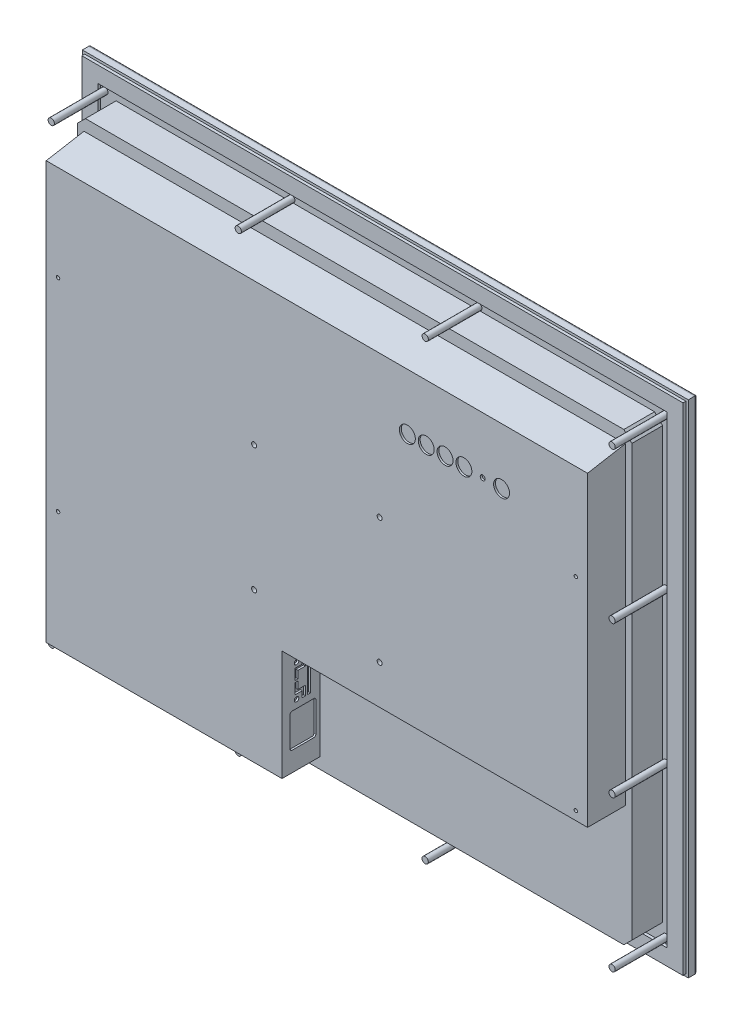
SolidWorks part; units mm, degrees
ref_plane "Front Plane" through (0, 0, 0) normal (0, 0, 1) x (1, 0, 0)
ref_plane "Top Plane" through (0, 0, 0) normal (0, 1, 0) x (1, 0, 0)
ref_plane "Right Plane" through (0, 0, 0) normal (1, 0, 0) x (0, 0, -1)
sketch "Sketch1" plane through (0, 0, 0) normal (0, 0, 1) x (1, 0, 0)
  line L0 (-241.3, 199.39) -> (241.3, 199.39)
  line L1 (241.3, 199.39) -> (241.3, -199.39)
  line L2 (241.3, -199.39) -> (-241.3, -199.39)
  line L3 (-241.3, -199.39) -> (-241.3, 199.39)
  point P2 (0, -199.39)
  point P3 (241.3, 0)
  dimension "D1" = 482.6
  dimension "D2" = 398.78
extrude "Bezel" add sketch "Sketch1" against normal blind 7.112
fillet "Bezel Radius" radius 2 4 edges at (0, -199.39, -7.112) (0, 199.39, -7.112) (-241.3, 0, -7.112) (241.3, 0, -7.112)
sketch "Sketch2" plane through (0, 0, -7.112) normal (0, 0, -1) x (-1, 0, 0)
  line L0 (-204.597, 153.797) -> (204.597, 153.797)
  line L1 (204.597, 153.797) -> (204.597, -153.797)
  line L2 (204.597, -153.797) -> (-204.597, -153.797)
  line L3 (-204.597, -153.797) -> (-204.597, 153.797)
  line L4 (239.3, 197.39) -> (-239.3, 197.39) construction
  line L5 (-239.3, 197.39) -> (-239.3, -197.39) construction
  point P0 (0, 153.797)
  point P6 (0, 197.39)
  point P8 (-204.597, 0)
  point P11 (-239.3, 0)
  dimension "D1" = 409.194
  dimension "D2" = 307.594
extrude "Window" cut sketch "Sketch2" against normal blind 2.35
sketch "Sketch3" plane through (0, 0, 0) normal (0, 0, 1) x (1, 0, 0)
  line L4 (-239.395, 197.485) -> (239.395, 197.485)
  line L5 (239.395, 197.485) -> (239.395, -197.485)
  line L6 (239.395, -197.485) -> (-239.395, -197.485)
  line L7 (-239.395, -197.485) -> (-239.395, 197.485)
  line L8 (241.3, 199.39) -> (-241.3, 199.39) construction
  line L9 (-241.3, 199.39) -> (-241.3, -199.39) construction
  line L10 (-241.3, -199.39) -> (241.3, -199.39) construction
  line L11 (241.3, -199.39) -> (241.3, 199.39) construction
  line L12 (-226.695, -184.785) -> (-226.695, 184.785)
  line L13 (-226.695, 184.785) -> (226.695, 184.785)
  line L14 (226.695, 184.785) -> (226.695, -184.785)
  line L15 (226.695, -184.785) -> (-226.695, -184.785)
  dimension "D1" = 1.905
  dimension "D2" = 1.905
  dimension "D3" = 1.905
  dimension "D4" = 1.905
  dimension "D5" = 12.7
extrude "Gasket" add sketch "Sketch3" along normal blind 2.3
sketch "Sketch5" plane through (0, 0, 0) normal (0, 0, 1) x (1, 0, 0)
  line L0 (-241.3, 199.39) -> (-241.3, -199.39) construction
  line L1 (241.3, 199.39) -> (-241.3, 199.39) construction
  line L2 (-241.3, -199.39) -> (241.3, -199.39) construction
  line L4 (241.3, -199.39) -> (241.3, 199.39) construction
  circle A0 centre (-223.3168, 180.213) radius 2.5
  circle A6 centre (-223.3168, -180.213) radius 2.5
  circle A8 centre (-74.4389, 180.213) radius 2.5
  circle A9 centre (-74.4389, -180.213) radius 2.5
  circle A10 centre (74.4389, 180.213) radius 2.5
  circle A11 centre (74.4389, -180.213) radius 2.5
  circle A12 centre (223.3168, 180.213) radius 2.5
  circle A13 centre (223.3168, -180.213) radius 2.5
  circle A14 centre (-223.3168, 60.071) radius 2.5
  circle A15 centre (223.3168, 60.071) radius 2.5
  circle A16 centre (-223.3168, -60.071) radius 2.5
  circle A17 centre (223.3168, -60.071) radius 2.5
  dimension "D1" = 5
  dimension "D2" = 17.9832
  dimension "D3" = 19.177
  dimension "D4" = 19.177
  dimension "D5" = 17.9832
  dimension "D6" = 4
  dimension "D7" = 3
  dimension "D8" = 120.142
  dimension "D9" = 148.8779
extrude "Panel Frame Studs" add sketch "Sketch5" along normal blind 42.7
sketch "Sketch6" plane through (0, 0, 0) normal (0, 0, 1) x (1, 0, 0)
  line L0 (-220.8168, 171.3011) -> (-214.4049, 177.713)
  line L1 (-214.4049, 177.713) -> (214.4049, 177.713)
  line L2 (214.4049, 177.713) -> (220.8168, 171.3011)
  line L3 (220.8168, 171.3011) -> (220.8168, -171.3011)
  line L4 (220.8168, -171.3011) -> (214.4049, -177.713)
  line L5 (214.4049, -177.713) -> (-214.4049, -177.713)
  line L6 (-214.4049, -177.713) -> (-220.8168, -171.3011)
  line L7 (-220.8168, -171.3011) -> (-220.8168, 171.3011)
  circle A0 centre (-223.3168, 180.213) radius 2.5 construction
  circle A1 centre (223.3168, 180.213) radius 2.5 construction
  circle A2 centre (-223.3168, -180.213) radius 2.5 construction
  dimension "D1" = 9.0678
  dimension "D2" = 45
extrude "Body" add sketch "Sketch6" along normal blind 24.4348 separate body
sketch "Sketch7" plane through (0, 0, 24.4348) normal (0, 0, 1) x (1, 0, 0)
  line L0 (-215.5571, 168.402) -> (215.5571, 168.402)
  line L1 (215.5571, 168.402) -> (215.5571, -81.153)
  line L2 (215.5571, -81.153) -> (-27.7749, -81.153)
  line L3 (-27.7749, -81.153) -> (-27.7749, -169.164)
  line L4 (-27.7749, -169.164) -> (-215.5571, -169.164)
  line L5 (-215.5571, -169.164) -> (-215.5571, 168.402)
  line L6 (-214.4049, -177.713) -> (214.4049, -177.713) construction
  line L7 (-241.3, -199.39) -> (241.3, -199.39) construction
  line L9 (-220.8168, 171.3011) -> (-220.8168, -171.3011) construction
  point P3 (0, 168.402)
  dimension "D1" = 431.1142
  dimension "D2" = 249.555
  dimension "D3" = 243.332
  dimension "D4" = 88.011
  dimension "D5" = 30.226
extrude "Rear Cover" add sketch "Sketch7" along normal blind 30.0482
draft "Rear Cover Slope" type of draft neutral plane draft angle 10 faces to draft 1 parameters "D1"=10
hole_wizard "Ø4.0mm VESA Holes" positions "Sketch8" profile "Sketch9" hole size "Ø4.0" standard "ANSI Metric"
sketch "Sketch8" plane through (0, 0, 54.483) normal (0, 0, 1) x (1, 0, 0)
  line L0 (-241.3, -199.39) -> (241.3, -199.39) construction
  line L1 (-241.3, 199.39) -> (-241.3, -199.39) construction
  point P0 (-50.0126, 49.962)
  point P2 (49.9874, 49.962)
  point P4 (49.9874, -50.038)
  point P6 (-50.0126, -50.038)
  dimension "D1" = 100
  dimension "D2" = 100
  dimension "D3" = 149.352
  dimension "D4" = 191.2874
sketch "Sketch9" plane through (-50.0126, 49.962, 54.483) normal (1, 0, 0) x (0, -1, 0)
  line L0 (0, 0) -> (0, 17.2037)
  line L1 (0, 17.2037) -> (2, 16.002)
  line L2 (2, 16.002) -> (2, 0)
  line L5 (2, 0) -> (0, 0)
  line L10 (0, 17.2037) -> (-2, 16.002) construction
  line L11 (0, -6.35) -> (0, 107.95) construction
  dimension "Hole Dia." = 4
  dimension "Hole Depth" = 16.002
  dimension "Drill Angle" = 118
sketch "Sketch10" plane through (0, -81.153, 0) normal (0, 1, 0) x (1, 0, 0)
  line L0 (215.5571, -54.483) -> (215.5571, -24.4348) construction
  line L1 (-27.7749, -54.483) -> (215.5571, -54.483) construction
  line L53 (75.9599, -38.5133) -> (75.9599, -33.4333)
  line L54 (51.6839, -41.6858) -> (72.9119, -41.6858)
  line L55 (51.6839, -30.2609) -> (72.9119, -30.2609)
  line L56 (48.6359, -33.4333) -> (48.6359, -38.5133)
  line L57 (110.1283, -34.9446) -> (110.1283, -40.0246)
  line L58 (92.8563, -43.1971) -> (107.0803, -43.1971)
  line L59 (89.8083, -34.9446) -> (89.8083, -40.0246)
  line L60 (92.8563, -31.7722) -> (106.9527, -31.7696)
  line L61 (134.4777, -33.954) -> (134.4777, -39.034)
  line L62 (151.7497, -30.7816) -> (137.5257, -30.7816)
  line L63 (154.7977, -39.034) -> (154.7977, -33.954)
  line L64 (137.5257, -42.2065) -> (151.6221, -42.209)
  line L65 (186.4163, -30.3853) -> (170.4143, -30.3853)
  line L66 (186.4163, -38.0688) -> (186.4163, -42.5773)
  line L67 (170.4143, -42.5773) -> (186.4163, -42.5773)
  line L68 (170.4143, -38.0688) -> (170.4143, -42.5773)
  line L69 (165.9693, -38.0688) -> (170.4143, -38.0688)
  line L70 (165.9693, -34.8938) -> (170.4143, -34.8938)
  line L71 (170.4143, -30.3853) -> (170.4143, -34.8938)
  line L72 (186.4163, -34.8938) -> (186.4163, -30.3853)
  line L73 (186.4163, -38.0688) -> (190.8613, -38.0688)
  line L74 (186.4163, -34.8938) -> (190.8613, -34.8938)
  circle A42 centre (78.5539, -35.9733) radius 1.5875
  arc A43 (75.9599, -38.5133) -> (72.9119, -41.6858) centre (72.7849, -38.5133) cw
  arc A44 (72.9119, -30.2609) -> (75.9599, -33.4333) centre (72.7849, -33.4333) cw
  arc A45 (48.6359, -33.4333) -> (51.6839, -30.2609) centre (51.8109, -33.4333) cw
  arc A46 (51.6839, -41.6858) -> (48.6359, -38.5133) centre (51.8109, -38.5133) cw
  circle A47 centre (46.0419, -35.9733) radius 1.5875
  arc A48 (92.8563, -43.1971) -> (89.8083, -40.0246) centre (92.9833, -40.0246) cw
  circle A49 centre (112.4683, -37.4973) radius 1.5875
  arc A50 (110.1283, -40.0246) -> (107.0803, -43.1971) centre (106.9533, -40.0246) cw
  circle A51 centre (87.4683, -37.4973) radius 1.5875
  arc A52 (89.8083, -34.9446) -> (92.8563, -31.7722) centre (92.9833, -34.9446) cw
  arc A53 (106.9527, -31.7696) -> (110.1283, -34.9446) centre (106.9533, -34.9446) cw
  circle A54 centre (132.1377, -36.4813) radius 1.5875
  arc A55 (134.4777, -33.954) -> (137.5257, -30.7816) centre (137.6527, -33.954) cw
  arc A56 (151.7497, -30.7816) -> (154.7977, -33.954) centre (151.6227, -33.954) cw
  arc A57 (154.7977, -39.034) -> (151.6221, -42.209) centre (151.6227, -39.034) cw
  arc A58 (137.5257, -42.2065) -> (134.4777, -39.034) centre (137.6527, -39.034) cw
  circle A59 centre (157.1377, -36.4813) radius 1.5875
  arc A60 (165.9693, -38.0688) -> (165.9693, -34.8938) centre (165.9693, -36.4813) cw
  arc A61 (190.8613, -34.8938) -> (190.8613, -38.0688) centre (190.8613, -36.4813) cw
  dimension "D1" = 24.6958
  dimension "D2" = 18.0017
extrude "Video / Touch Interface" cut sketch "Sketch10" along normal blind 1.524 from surface at 0
sketch "Sketch11" plane through (-27.7749, 0, 0) normal (-1, 0, 0) x (0, 0, 1)
  line L0 (54.483, -169.164) -> (24.4348, -169.164) construction
  line L1 (54.483, -169.164) -> (54.483, -81.153) construction
  line L49 (38.4302, -121.4035) -> (38.4302, -116.5902)
  line L50 (38.4302, -121.4035) -> (35.8902, -121.4035)
  line L51 (35.8902, -121.4035) -> (35.8902, -114.0502)
  line L52 (34.3662, -93.4635) -> (34.3662, -121.4035)
  line L53 (34.3662, -121.4035) -> (31.8262, -121.4035)
  line L54 (31.8262, -121.4035) -> (31.8262, -93.4635)
  line L55 (31.8262, -93.4635) -> (34.3662, -93.4635)
  line L56 (35.8902, -93.4635) -> (38.4302, -93.4635)
  line L57 (38.4302, -93.4635) -> (38.4302, -98.2768)
  line L58 (35.8902, -93.4635) -> (35.8902, -100.8168)
  line L59 (35.8902, -100.8168) -> (41.783, -100.8168)
  line L60 (38.4302, -98.2768) -> (44.323, -98.2768)
  line L61 (44.323, -98.2768) -> (44.323, -106.6715)
  line L62 (44.323, -106.6715) -> (41.783, -106.6715)
  line L63 (41.783, -100.8168) -> (41.783, -106.6715)
  line L64 (41.783, -108.1955) -> (44.323, -108.1955)
  line L65 (44.323, -116.5902) -> (44.323, -108.1955)
  line L66 (41.783, -108.1955) -> (41.783, -114.0502)
  line L67 (35.8902, -114.0502) -> (41.783, -114.0502)
  line L68 (38.4302, -116.5902) -> (44.323, -116.5902)
  line L69 (27.5719, -128.1357) -> (27.5719, -152.0752)
  line L70 (29.0959, -126.6117) -> (46.5473, -126.6117)
  line L71 (48.0698, -152.0752) -> (48.0698, -128.1357)
  line L72 (46.5458, -153.5992) -> (29.0944, -153.5992)
  circle A12 centre (42.926, -120.2224) radius 1.7907
  circle A13 centre (42.926, -94.6446) radius 1.7907
  arc A14 (29.0944, -153.5992) -> (27.5719, -152.0752) centre (29.0959, -152.0752) cw
  arc A15 (27.5719, -128.1357) -> (29.0959, -126.6117) centre (29.0959, -128.1357) cw
  arc A16 (46.5473, -126.6117) -> (48.0698, -128.1357) centre (46.5458, -128.1357) cw
  arc A17 (48.0698, -152.0752) -> (46.5458, -153.5992) centre (46.5458, -152.0752) cw
  dimension "D1" = 15.5648
  dimension "D2" = 6.4132
extrude "Power AC and DC" cut sketch "Sketch11" along normal blind 1.524 from surface at 0
sketch "Sketch12" plane through (0, 0, 54.483) normal (0, 0, 1) x (1, 0, 0)
  line L0 (-241.3, -199.39) -> (241.3, -199.39) construction
  line L1 (-241.3, 199.39) -> (-241.3, -199.39) construction
  circle A6 centre (72.0533, 118.2217) radius 6.35
  circle A7 centre (87.0533, 118.2217) radius 6.35
  circle A8 centre (102.0533, 118.2217) radius 6.35
  circle A9 centre (117.0533, 118.2217) radius 6.35
  circle A10 centre (132.0533, 118.2217) radius 1.9812
  circle A11 centre (147.0533, 118.2217) radius 6.35
  dimension "D1" = 317.6117
  dimension "D2" = 313.3533
extrude "Controls Buttons" cut sketch "Sketch12" against normal blind 1.524 from surface at 0
hole_wizard "6-32 Accessory Bracket Holes" positions "Sketch13" profile "Sketch14" hole size "#6-32" standard "ANSI Inch"
sketch "Sketch13" plane through (0, 0, 54.483) normal (0, 0, 1) x (1, 0, 0)
  line L0 (-241.3, 199.39) -> (-241.3, -199.39) construction
  line L1 (-241.3, -199.39) -> (241.3, -199.39) construction
  point P0 (-206.121, -74.1934)
  point P2 (-206.121, 87.1474)
  point P4 (206.1718, 87.1474)
  point P6 (206.1718, -74.1934)
  dimension "D1" = 161.3408
  dimension "D2" = 412.2928
  dimension "D3" = 35.179
  dimension "D4" = 125.1966
sketch "Sketch14" plane through (-206.121, -74.1934, 54.483) normal (1, 0, 0) x (0, -1, 0)
  line L0 (0, 0) -> (0, 16.8147)
  line L1 (0, 16.8147) -> (1.3525, 16.002)
  line L2 (1.3525, 16.002) -> (1.3525, 0)
  line L5 (1.3525, 0) -> (0, 0)
  line L10 (0, 16.8147) -> (-1.3526, 16.002) construction
  line L11 (0, -6.35) -> (0, 107.95) construction
  dimension "Hole Dia." = 2.7051
  dimension "Hole Depth" = 16.002
  dimension "Drill Angle" = 118
